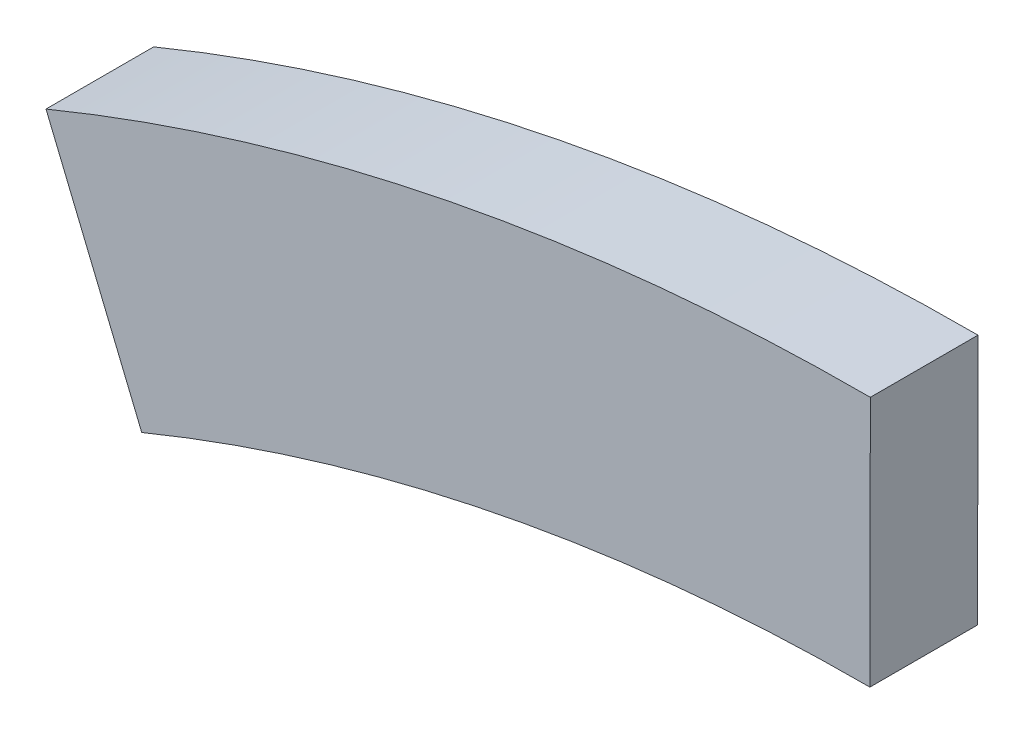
SolidWorks part; units mm, degrees
ref_plane "Front Plane" through (0, 0, 0) normal (0, 0, 1) x (1, 0, 0)
ref_plane "Top Plane" through (0, 0, 0) normal (0, 1, 0) x (1, 0, 0)
ref_plane "Right Plane" through (0, 0, 0) normal (1, 0, 0) x (0, 0, -1)
sketch "Sketch2" plane through (0, 0, 0) normal (0, 0, 1) x (1, 0, 0)
  line L0 (0, 0) -> (-33.881, 82.1906)
  line L1 (257.6709, 50.799) -> (257.8219, 139.6989)
  line L2 (-33.881, 139.7) -> (257.6709, 139.7) construction
  line L3 (-33.881, 139.7) -> (-33.881, 0) construction
  line L4 (-33.881, 0) -> (257.6709, 0) construction
  line L5 (257.6709, 0) -> (257.6709, 139.7) construction
  arc A0 (0, 0) -> (257.6709, 50.799) centre (256.5274, -622.3) cw
  arc A1 (-33.881, 82.1906) -> (257.8219, 139.6989) centre (256.5274, -622.3) cw
  dimension "D1" = 673.1
  dimension "D2" = 762
  dimension "D6" = 88.9
  dimension "D3" = 139.7
  dimension "D4" = 22.5
  dimension "D5" = 291.5519
extrude "Boss-Extrude1" add sketch "Sketch2" along normal blind 38.1
